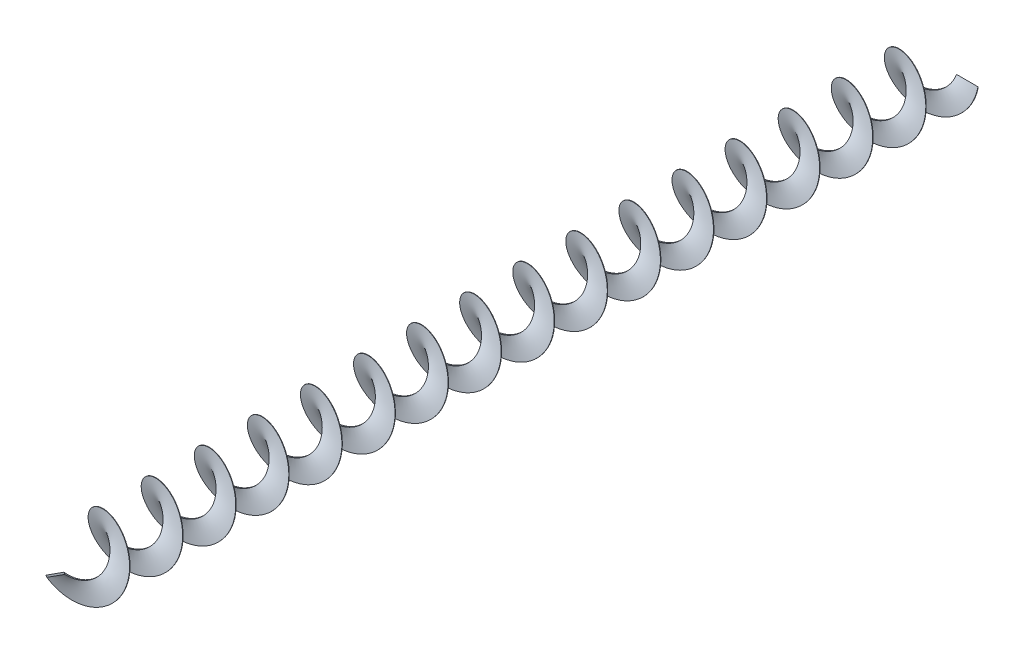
SolidWorks part; units mm, degrees
ref_plane "Front Plane" through (0, 0, 0) normal (0, 0, 1) x (1, 0, 0)
ref_plane "Top Plane" through (0, 0, 0) normal (0, 1, 0) x (1, 0, 0)
ref_plane "Right Plane" through (0, 0, 0) normal (1, 0, 0) x (0, 0, -1)
sketch "Sketch1" plane through (0, 0, 0) normal (0, 0, 1) x (1, 0, 0)
  circle A0 centre (0, 0) radius 154.5
  circle A1 centre (0, 0) radius 54 construction
  dimension "D1" = 309
  dimension "D2" = 108
curve "Helix/Spiral1"
sketch "Sketch2" plane through (0, 0, 0) normal (0, 0, 1) x (1, 0, 0)
  line L0 (155, 0) -> (0, 0) construction
  line L1 (54, -4) -> (155, -4)
  line L2 (54, -4) -> (54, 4)
  line L3 (54, 4) -> (155, 4)
  line L4 (155, -4) -> (155, 4)
  circle A0 centre (0, 0) radius 54 construction
  dimension "D1" = 155
  dimension "D3" = 8
sweep "Sweep1" add profiles "Sketch2" path "Helix/Spiral1"
